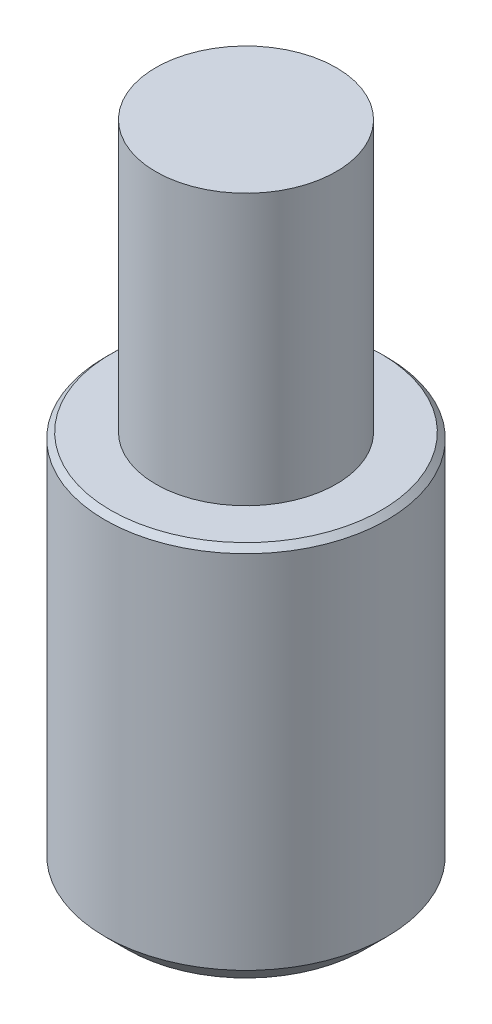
SolidWorks part; units mm, degrees
ref_plane "Front Plane" through (0, 0, 0) normal (0, 0, 1) x (1, 0, 0)
ref_plane "Top Plane" through (0, 0, 0) normal (0, 1, 0) x (1, 0, 0)
ref_plane "Right Plane" through (0, 0, 0) normal (1, 0, 0) x (0, 0, -1)
sketch "Sketch1" plane through (0, 0, 0) normal (0, 1, 0) x (1, 0, 0)
  circle A0 centre (0, 0) radius 3.175
  dimension "D1" = 6.35
extrude "Extrude1" add sketch "Sketch1" along normal blind 8.763
sketch "Sketch2" plane through (0, 8.763, 0) normal (0, 1, 0) x (1, 0, 0)
  circle A0 centre (0, 0) radius 2.032
  dimension "D1" = 4.064
extrude "Extrude2" add sketch "Sketch2" along normal blind 6.096
chamfer "Chamfer1" distance 0.127 angle 45 1 edges at (0, 8.763, 3.175)
sketch "Sketch3" plane through (0, 0, 0) normal (0, -1, 0) x (1, 0, 0)
  line L1 (0.9165, 1.5875) -> (-0.9165, 1.5875)
  line L2 (-0.9165, 1.5875) -> (-1.8331, 0)
  line L3 (-1.8331, 0) -> (-0.9165, -1.5875)
  line L4 (-0.9165, -1.5875) -> (0.9165, -1.5875)
  line L5 (0.9165, -1.5875) -> (1.8331, 0)
  line L6 (1.8331, 0) -> (0.9165, 1.5875)
  circle A0 centre (0, 0) radius 1.5875 construction
  dimension "D1" = 3.175
extrude "Extrude3" cut sketch "Sketch3" against normal blind 3.175
chamfer "Chamfer2" distance 0.508 angle 45 1 edges at (0, 0, 3.175)
